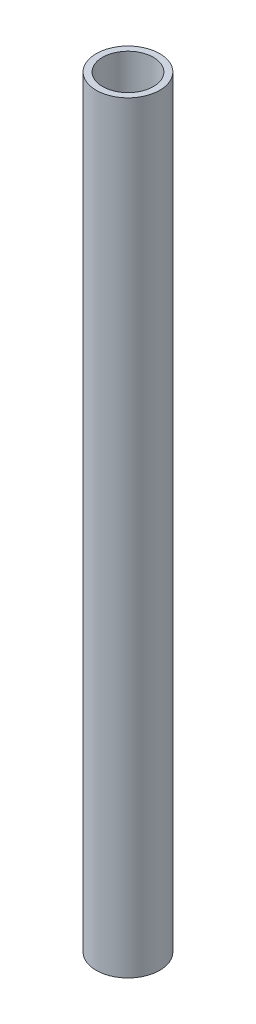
SolidWorks part; units mm, degrees
ref_plane "前视基准面" through (0, 0, 0) normal (0, 0, 1) x (1, 0, 0)
ref_plane "上视基准面" through (0, 0, 0) normal (0, 1, 0) x (1, 0, 0)
ref_plane "右视基准面" through (0, 0, 0) normal (1, 0, 0) x (0, 0, -1)
other "Configuration Table"
sketch "草图1" plane through (0, 0, 0) normal (0, 1, 0) x (1, 0, 0)
  circle A0 centre (0, 0) radius 4
  circle A1 centre (0, 0) radius 5
  dimension "D1" = 8
  dimension "D2" = 10
extrude "凸台-拉伸1" add sketch "草图1" along normal blind 120
